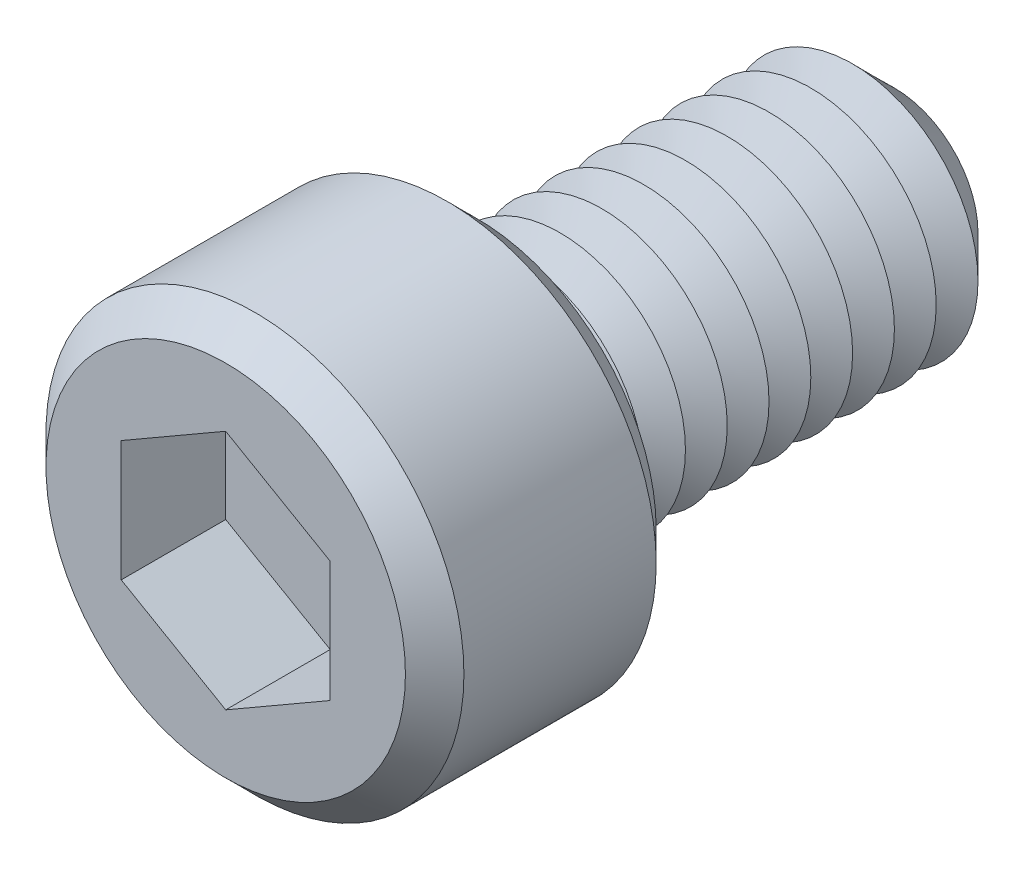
SolidWorks part; units mm, degrees
ref_plane "Front Plane" through (0, 0, 0) normal (0, 0, 1) x (1, 0, 0)
ref_plane "Top Plane" through (0, 0, 0) normal (0, 1, 0) x (1, 0, 0)
ref_plane "Right Plane" through (0, 0, 0) normal (1, 0, 0) x (0, 0, -1)
sketch "Sketch1" plane through (0, 0, 0) normal (0, 0, 1) x (1, 0, 0)
  circle A0 centre (0, 0) radius 5
  dimension "D1" = 10
extrude "Boss-Extrude1" add sketch "Sketch1" along normal blind 6
sketch "Sketch2" plane through (0, 0, 0) normal (0, 0, -1) x (-1, 0, 0)
  circle A0 centre (0, 0) radius 3
  dimension "D1" = 6
extrude "Boss-Extrude2" add sketch "Sketch2" along normal blind 10
chamfer "Chamfer1" distance 1 angle 45 1 edges at (-3, 0, -10)
sketch "Sketch3" plane through (0, 0, 0) normal (1, 0, 0) x (0, 0, -1)
  line L0 (-2.5121, 0) -> (4.5776, 0) construction
sketch "Sketch4" plane through (0, 0, 0) normal (1, 0, 0) x (0, 0, -1)
  line L0 (0, 3) -> (0.5, 2.134)
  line L1 (0.5, 2.134) -> (1, 3)
  line L2 (9, 3) -> (0, 3) construction
  line L3 (1, 3) -> (0, 3)
  dimension "D1" = 1
revolve "Cut-Revolve1" cut sketch "Sketch4" angle 360 about L0
pattern_linear "LPattern1" count 9 spacing 1 along (0, 0, -1) of "Cut-Revolve1"
sketch "Sketch5" plane through (0, 0, 6) normal (0, 0, 1) x (1, 0, 0)
  line L1 (0, 2.8868) -> (-2.5, 1.4434)
  line L2 (-2.5, 1.4434) -> (-2.5, -1.4434)
  line L3 (-2.5, -1.4434) -> (0, -2.8868)
  line L4 (0, -2.8868) -> (2.5, -1.4434)
  line L5 (2.5, -1.4434) -> (2.5, 1.4434)
  line L6 (2.5, 1.4434) -> (0, 2.8868)
  circle A0 centre (0, 0) radius 2.5 construction
  dimension "D1" = 5
extrude "Cut-Extrude1" cut sketch "Sketch5" against normal blind 2.5
sketch "Sketch6" plane through (0, 0, 3.5) normal (0, 0, 1) x (1, 0, 0)
  circle A0 centre (0, 0) radius 0.8
  dimension "D1" = 1.6
extrude "Cut-Extrude2" cut sketch "Sketch6" against normal up to surface (13.5 mm away)
chamfer "Chamfer2" distance 0.7 angle 45 2 edges at (5, 0, 0) (5, 0, 6)
